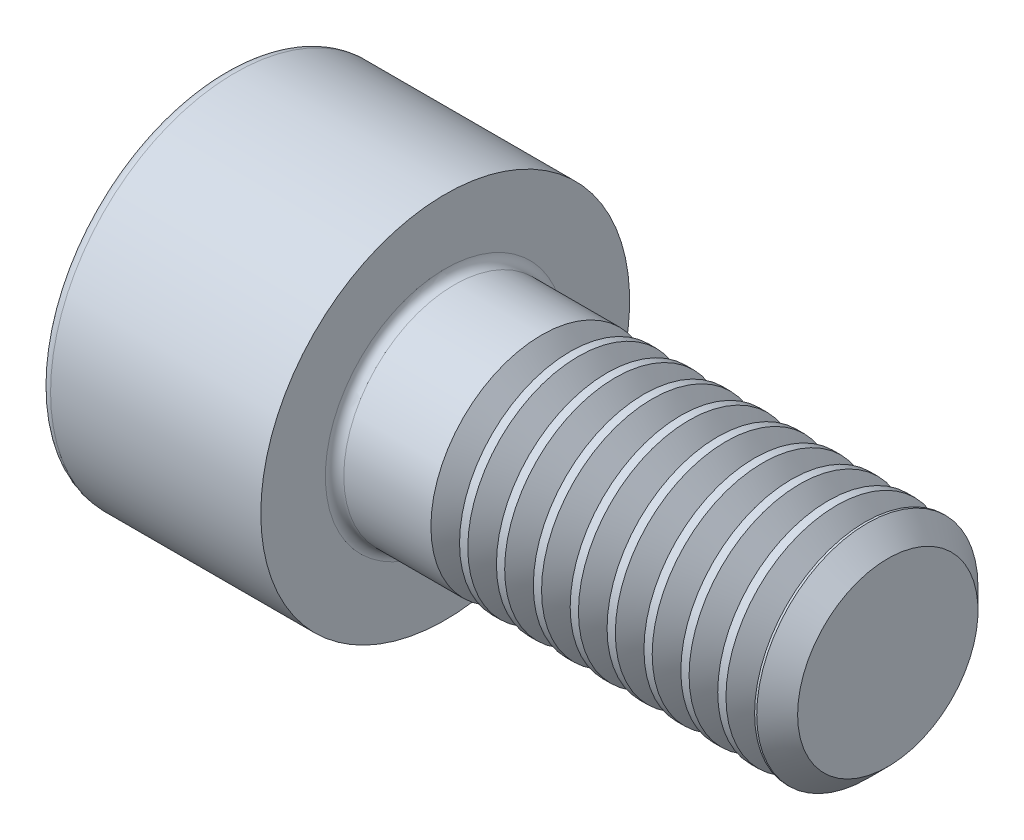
SolidWorks part; units mm, degrees
ref_plane "Plane1" through (0, 0, 0) normal (0, 0, 1) x (1, 0, 0)
ref_plane "Plane2" through (0, 0, 0) normal (0, 1, 0) x (1, 0, 0)
ref_plane "Plane3" through (0, 0, 0) normal (1, 0, 0) x (0, 0, -1)
sketch "BodySke" plane through (0, 0, 0) normal (0, 0, 1) x (1, 0, 0)
  line L0 (0, 0) -> (0, 5)
  line L1 (0, 5) -> (6, 5)
  line L2 (6, 5) -> (6, 3)
  line L3 (6, 3) -> (17.4455, 3)
  line L4 (18, 2.4455) -> (18, 0)
  line L5 (18, 0) -> (0, 0)
  line L6 (-31.75, 0) -> (127, 0) construction
  line L8 (18, 2.4455) -> (17.4455, 3)
  line L10 (18, -2.4455) -> (17.4455, -3) construction
  line L11 (7, 9.525) -> (7, 3.175) construction
  line L12 (6, 9.525) -> (6, 3.175) construction
  line L13 (-42, 9.525) -> (-42, 3.175) construction
  dimension "Diameter" = 6
  dimension "Head_ht" = 6
  dimension "Length" = 12
  dimension "Body_ch_ang" = 45
  dimension "Head_dia" = 10
  dimension "Minor_dia" = 4.891
  dimension "Advance" = 1
  dimension "Thread_nom" = 12
  dimension "Thread_length" = 60
revolve "Base-Revolve" add sketch "BodySke"
fillet "Fillet1" radius 0.25 1 edges at (6, 0, 3)
fillet "Fillet2" radius 0.3 1 edges at (0, 0, 5)
sketch "Sketch2" plane through (0, 0, 0) normal (0, 0, 1) x (1, 0, 0)
  line L0 (0, 2.542) -> (3, 2.542)
  line L1 (3, 2.542) -> (4.4676, 0)
  line L2 (-31.75, 0) -> (127, 0) construction
  line L3 (4.4676, 0) -> (0, 0)
  line L4 (0, 0) -> (0, 2.542)
  line L6 (0, 0) -> (47.625, 0) construction
  dimension "D1" = 2.542
  dimension "D2" = 60
  dimension "Depth" = 3
revolve "Hex-PreBroach" cut sketch "Sketch2" angle 360 about L6
sketch "Sketch3" plane through (0, 0, 0) normal (-1, 0, 0) x (0, 0.5, 0.866)
  line L0 (1.4676, 2.542) -> (-1.4676, 2.542)
  line L1 (-1.4676, 2.542) -> (-2.9352, 0)
  line L2 (1.4676, 2.542) -> (2.9352, 0)
  line L3 (1.4676, -2.542) -> (2.9352, 0)
  line L4 (1.4676, -2.542) -> (-1.4676, -2.542)
  line L5 (-1.4676, -2.542) -> (-2.9352, 0)
  dimension "D1" = 2.542
  dimension "D2" = 2.542
  dimension "Hex_size" = 5.084
extrude "Hex" cut sketch "Sketch3" against normal blind 3
sketch "ThdSchSke" plane through (0, 0, 0) normal (0, 0, 1) x (1, 0, 0)
  line L0 (9, -2.4455) -> (8.6117, -3)
  line L1 (9, -2.4455) -> (9.3883, -3)
  line L2 (9.3883, -3) -> (9.3883, -3.75)
  line L3 (-3.175, 0) -> (5.1513, 0) construction
  line L4 (0, 4.7) -> (0, -4.7) construction
  line L5 (9.3883, -3.75) -> (8.6117, -3.75)
  line L6 (8.6117, -3.75) -> (8.6117, -3)
  dimension "Thread_minor" = 4.891
  dimension "Diameter" = 6
  dimension "Start" = 9
  dimension "SideAngle" = 55
  dimension "VeeAngle" = 70
  dimension "Overcut" = 7.5
revolve "ThreadSchematic" cut sketch "ThdSchSke" angle 360 about L3
pattern_linear "ThdSchPat" count 9 spacing 1 along (1, 0, 0) of "ThreadSchematic"
equation "\"D2@Sketch3\" = \"Hex_size@Sketch3\" / 2"
equation "\"D1@Sketch3\" = \"Hex_size@Sketch3\" / 2"
equation "\"D1@Sketch2\" = \"Hex_size@Sketch3\" / 2"
equation "\"Thread_minor@ThreadCosmetic\"  =  \"Minor_dia@BodySke\""
equation "\"Depth@Sketch2\" =  \"Key_eng@Hex\""
equation "\"Thread_length@ThreadCosmetic\" = ((sgn( (\"Length@BodySke\" - \"Advance@BodySke\" * 3.0) - \"Thread_nom@BodySke\" )-1)*( (\"Length@BodySke\" - \"Advance@BodySke\" * 3.0) - \"Thread_nom@BodySke\" ))/-2+ \"Thread_no"
equation "\"Thread_minor@ThdSchSke\" = \"Minor_dia@BodySke\""
equation "\"Diameter@ThdSchSke\" = \"Diameter@BodySke\""
equation "\"Overcut@ThdSchSke\" = \"Diameter@BodySke\" * 1.25"
equation "\"Start@ThdSchSke\" = \"Head_ht@BodySke\" + \"Length@BodySke\" - \"Thread_length@ThreadCosmetic\"  '---Non-countersunk---"
equation "\"Num_threads@ThdSchPat\" = int( \"Thread_length@ThreadCosmetic\" / \"Advance@BodySke\" + 0.999 )  + 1"
equation "\"Advance@ThdSchPat\" = \"Thread_length@ThreadCosmetic\" /  (\"Num_threads@ThdSchPat\" - 1) 'relax it"
equation "\"Num_threads@ThdSchPat\" = \"Num_threads@ThdSchPat\" - sgn( \"Num_threads@ThdSchPat\" - 1) '---chamfered tips only---"
